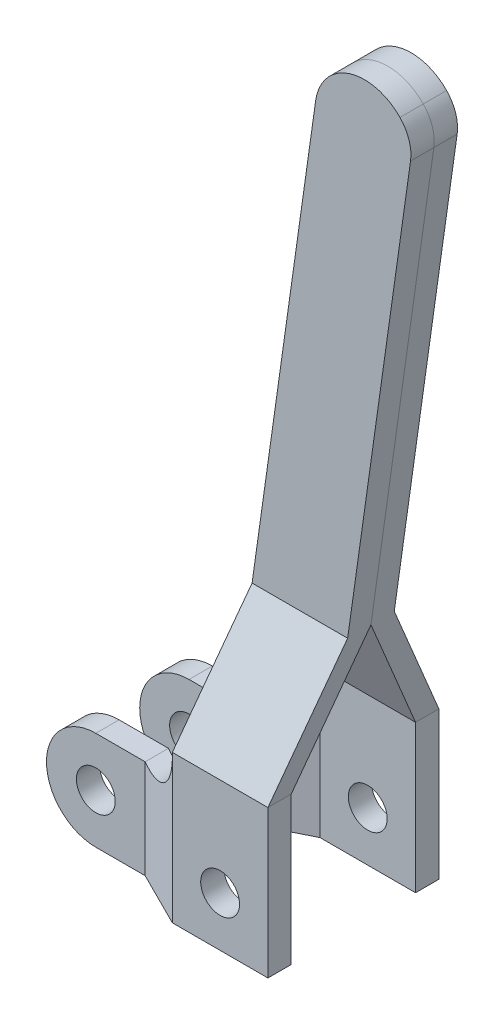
SolidWorks part; units mm, degrees
ref_plane "Front Plane" through (0, 0, 0) normal (0, 0, 1) x (1, 0, 0)
ref_plane "Top Plane" through (0, 0, 0) normal (0, 1, 0) x (1, 0, 0)
ref_plane "Right Plane" through (0, 0, 0) normal (1, 0, 0) x (0, 0, -1)
sketch "Sketch1" plane through (0, 0, 0) normal (0, 0, 1) x (1, 0, 0)
  line L0 (-6.35, 12.7) -> (0, 12.7)
  line L1 (0, 12.7) -> (0, 0)
  line L2 (0, 0) -> (-6.35, 0)
  arc A0 (-6.35, 0) -> (-6.35, 12.7) centre (-6.35, 6.35) cw
  circle A1 centre (-6.35, 6.35) radius 2.5
  point P3 (-12.7, 6.35)
  point P6 (0, 6.35)
  dimension "D2" = 5
  dimension "D3" = 6.35
  dimension "D1" = 12.7
extrude "Boss-Extrude1" add sketch "Sketch1" along normal blind 3
ref_plane "Plane1" through (0, 0, 6.5) normal (0, 0, 1) x (1, 0, 0)
sketch "Sketch2" plane through (0, 0, 6.5) normal (0, 0, 1) x (1, 0, 0)
  line L0 (7, 0) -> (7, 19)
  line L1 (7, 19) -> (19.3, 19)
  line L2 (19.3, 19) -> (19.3, 0)
  line L3 (19.3, 0) -> (7, 0)
  line L4 (-6.35, 8.85) -> (-6.35, 3.85) construction
  circle A0 centre (13.15, 6.4) radius 2.5
  circle A1 centre (-6.35, 6.35) radius 2.5 construction
  arc A2 (-6.35, 12.7) -> (-6.35, 0) centre (-6.35, 6.35) ccw construction
  point P2 (13.15, 0)
  point P13 (-6.35, 6.35)
  point P17 (-12.7, 6.35)
  dimension "D1" = 5
  dimension "D2" = 6.4
  dimension "D3" = 19.5
  dimension "D4" = 19
  dimension "D5" = 32
extrude "Boss-Extrude2" add sketch "Sketch2" against normal blind 3 separate body
sketch "Sketch3" plane through (0, 0, 0) normal (0, 1, 0) x (1, 0, 0)
  line L0 (0, -3) -> (0, 0)
  line L1 (0, 0) -> (7, -3.5)
  line L2 (7, -3.5) -> (7, -6.5)
  line L3 (7, -6.5) -> (0, -3)
extrude "Boss-Extrude3" add sketch "Sketch3" along normal up to vertex (19 mm away)
sketch "Sketch5" plane through (0, 0, 6.5) normal (0, 0, 1) x (1, 0, 0)
  line L0 (0, 19) -> (0, 12.7) construction
  line L1 (0, 19) -> (7, 19) construction
  line L4 (0, 12.7) -> (-4.8092, 20.8117)
  line L5 (-4.8092, 20.8117) -> (7, 21.4013)
  line L6 (7, 21.4013) -> (7, 19)
  arc A0 (0, 12.7) -> (7, 19) centre (1.0124, 18.614) ccw
  dimension "D1" = 6
extrude "Cut-Extrude1" cut sketch "Sketch5" against normal through all
ref_plane "Plane3" through (0, 35, 0) normal (0, 1, 0) x (1, 0, 0)
sketch "Sketch8" plane through (0, 35, 0) normal (0, 1, 0) x (1, 0, 0)
  line L0 (9.2624, 4.5) -> (9.2624, 1.5)
  line L1 (9.2624, 4.5) -> (21.5624, 4.5)
  line L2 (21.5624, 4.5) -> (21.5624, 1.5)
  line L3 (21.5624, 1.5) -> (9.2624, 1.5)
  dimension "D1" = 12.3
  dimension "D2" = 3
  dimension "D3" = 8
  dimension "D4" = 2.25
sketch "Sketch9" plane through (0, 19, 0) normal (0, 1, 0) x (1, 0, 0)
  line L0 (19.3, -6.5) -> (7, -6.5) construction
  line L1 (19.3, -3.5) -> (19.3, -6.5) construction
  line L2 (19.3, -3.5) -> (7, -3.5) construction
  line L3 (7, -3.5) -> (7, -6.5) construction
  line L4 (19.3, -6.5) -> (7, -6.5)
  line L5 (19.3, -3.5) -> (19.3, -6.5)
  line L6 (19.3, -3.5) -> (7, -3.5)
  line L7 (7, -3.5) -> (7, -6.5)
loft "Loft1" add profiles "Sketch8", "Sketch9"
sketch "Sketch10" plane through (0, 0, 6.5) normal (0, 0, 1) x (1, 0, 0)
  line L0 (9.2624, 35) -> (21.5624, 35)
  line L1 (21.5624, 35) -> (29.8597, 93.6784)
  line L3 (17.4481, 92.8891) -> (9.2624, 35)
  line L4 (9.2624, 35) -> (7, 19) construction
  arc A0 (17.4481, 92.8891) -> (29.8597, 93.6784) centre (23.7355, 92) cw
  dimension "D1" = 6.35
  dimension "D2" = 92
extrude "Boss-Extrude4" add sketch "Sketch10" against normal up to vertex (11 mm away)
ref_plane "Plane4" through (0, 0, -1.5) normal (0, 0, -1) x (-1, 0, 0)
sketch "Sketch13" plane through (0, 0, -1.5) normal (0, 0, -1) x (-1, 0, 0)
  line L0 (-21.5624, 35) -> (-9.2624, 35) construction
  line L1 (-17.4481, 92.8891) -> (-9.2624, 35) construction
  line L2 (-21.5624, 35) -> (-29.8597, 93.6784) construction
  line L3 (-21.5624, 35) -> (-9.2624, 35)
  line L4 (-17.4481, 92.8891) -> (-9.2624, 35)
  line L5 (-21.5624, 35) -> (-29.8597, 93.6784)
  arc A0 (-17.4481, 92.8891) -> (-29.8597, 93.6784) centre (-23.7355, 92) ccw construction
  arc A1 (-17.4481, 92.8891) -> (-29.8597, 93.6784) centre (-23.7355, 92) ccw
extrude "Cut-Extrude5" cut sketch "Sketch13" against normal through all
fillet "Fillet7" radius 5 1 edges at (29.8597, 93.6784, -3)
ref_plane "Plane5" through (0, 0, -4.5) normal (0, 0, -1) x (-1, 0, 0)
mirror "Mirror3" about plane through (0, 0, -4.5) normal (0, 0, -1)
